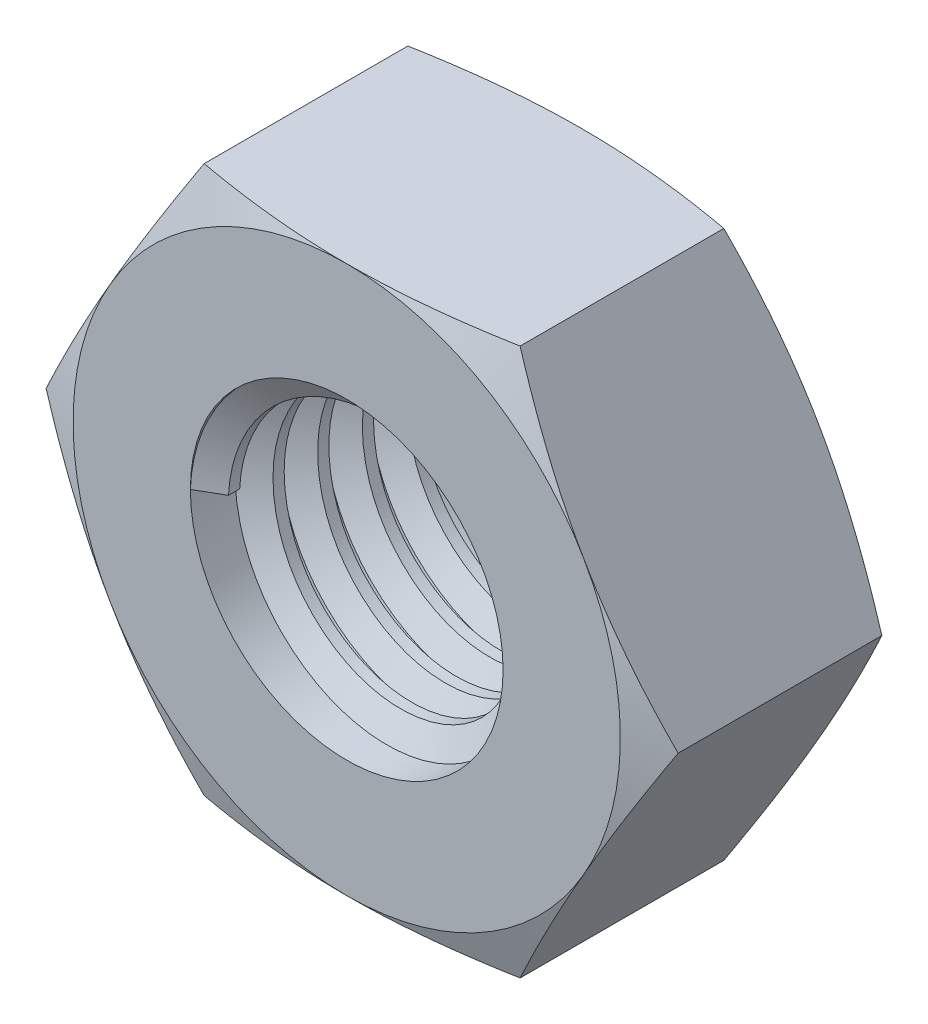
SolidWorks part; units mm, degrees
ref_plane "Front Plane" through (0, 0, 0) normal (0, 0, 1) x (1, 0, 0)
ref_plane "Top Plane" through (0, 0, 0) normal (0, 1, 0) x (1, 0, 0)
ref_plane "Right Plane" through (0, 0, 0) normal (1, 0, 0) x (0, 0, -1)
sketch "Sketch1" plane through (0, 0, 0) normal (0, 0, 1) x (1, 0, 0)
  line L1 (6.4158, 0) -> (3.2079, 5.5562)
  line L2 (3.2079, 5.5562) -> (-3.2079, 5.5562)
  line L3 (-3.2079, 5.5562) -> (-6.4158, 0)
  line L4 (-6.4158, 0) -> (-3.2079, -5.5563)
  line L5 (-3.2079, -5.5563) -> (3.2079, -5.5562)
  line L6 (3.2079, -5.5562) -> (6.4158, 0)
  circle A0 centre (0, 0) radius 5.5562 construction
  dimension "D1" = 11.1125
extrude "Boss-Extrude1" add sketch "Sketch1" along normal blind 4.7625
sketch "Sketch2" plane through (0, 0, 4.7625) normal (0, 0, 1) x (1, 0, 0)
  circle A0 centre (0, 0) radius 3.175
  dimension "D1" = 6.35
extrude "Cut-Extrude1" cut sketch "Sketch2" against normal through all
thread "Thread1" pitch 0.9071 start angle 0, offset 0, length 3.937, pitch 0.9071, diameter 6.35
ref_plane "Plane1" through (-3.175, 0, 4.7625) normal (0, -1, 0) x (-1, 0, 0)
sketch "Thread Profile1" plane through (-3.175, 0, 4.7625) normal (0, -1, 0) x (-1, 0, 0)
  line L0 (0, 0) -> (0, 0.9071) construction
  line L11 (0, 0) -> (0, 0.7937)
  line L12 (0, 0.7937) -> (-0.491, 0.5103)
  line L13 (-0.491, 0.5103) -> (-0.491, 0.2835)
  line L15 (-0.491, 0.2835) -> (0, 0)
  line L17 (-0.491, 0.3969) -> (0, 0.3969) construction
  point P2 (0, 0)
  dimension "Pitch" = 0.9071
  dimension "Profile_Angle" = 60
  dimension "Profile_Land" = 0.2268
  dimension "Profile_Height" = 0.491
sketch "Sketch5" plane through (0, 0, 0) normal (1, 0, 0) x (0, 0, -1)
  line L0 (-4.7625, 5.5562) -> (-4.7625, 8.0988)
  line L1 (-4.7625, 8.0988) -> (-3.8371, 8.0988)
  line L2 (-3.8371, 8.0988) -> (-4.7625, 5.5562)
  line L3 (0, 5.5562) -> (0, 8.2378)
  line L4 (0, 8.2378) -> (-0.976, 8.2378)
  line L5 (-0.976, 8.2378) -> (0, 5.5562)
  line L6 (0, 0) -> (1.5568, 0) construction
  dimension "D1" = 20
  dimension "D2" = 20
revolve "Cut-Revolve1" cut sketch "Sketch5" angle 360 about L6
